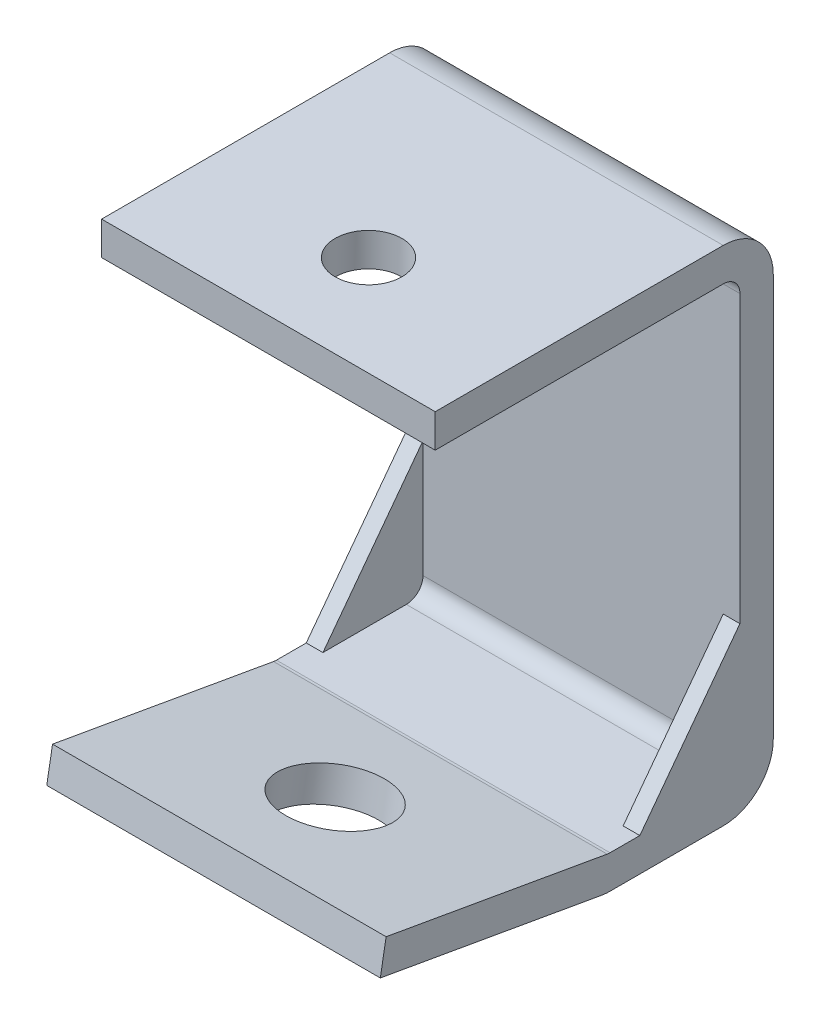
SolidWorks part; units mm, degrees
ref_plane "front" through (0, 0, 0) normal (0, 0, 1) x (1, 0, 0)
ref_plane "top" through (0, 0, 0) normal (0, 1, 0) x (1, 0, 0)
ref_plane "right" through (0, 0, 0) normal (1, 0, 0) x (0, 0, -1)
sketch "Sketch1" plane through (0, 0, 0) normal (1, 0, 0) x (0, 0, -1)
  line L0 (0, 0) -> (0, 83)
  line L1 (0, 83) -> (-58, 83)
  line L4 (-67.3467, 7.4669) -> (-25, 0)
  line L5 (-25, 0) -> (0, 0)
  dimension "D1" = 83
  dimension "D2" = 58
  dimension "D3" = 10
  dimension "D4" = 43
  dimension "D5" = 25
extrude "Base-Extrude-Thin" add sketch "Sketch1" along normal mid plane 63.5 thin
sketch "Sketch2" plane through (0, 89.35, 0) normal (0, 1, 0) x (-1, 0, 0)
  line L0 (0, 50) -> (0, -50) construction
  line L1 (-31.75, 58) -> (31.75, 58) construction
  circle A0 centre (0, 38.95) radius 6.35
  dimension "D1" = 12.7
  dimension "D2" = 19.05
extrude "Cut-Extrude1" cut sketch "Sketch2" against normal up to next
sketch "Sketch3" plane through (31.75, 0, 0) normal (1, 0, 0) x (0, 0, -1)
  line L0 (-24.7222, 0) -> (-3.175, 0) construction
  line L1 (0, 3.175) -> (0, 79.825) construction
  line L2 (-19.05, 0) -> (-3.175, 0)
  line L3 (0, 3.175) -> (0, 25.4)
  line L4 (-19.05, 0) -> (0, 25.4)
  arc A0 (-3.175, 0) -> (0, 3.175) centre (-3.175, 3.175) ccw construction
  arc A1 (-3.175, 0) -> (0, 3.175) centre (-3.175, 3.175) ccw
  dimension "D1" = 25.4
  dimension "D2" = 19.05
extrude "Boss-Extrude1" add sketch "Sketch3" against normal blind 3.175
mirror "Mirror1" about plane through (0, 0, 0) normal (1, 0, 0) of "Boss-Extrude1"
sketch "Sketch4" plane through (0, -4.2753, 0.7538) normal (0, 0.9848, -0.1736) x (-1, 0, 0)
  circle A0 centre (0, 45.2398) radius 9.525 construction
  circle A1 centre (0, 45.2398) radius 9.525
extrude "Cut-Extrude2" cut sketch "Sketch4" against normal through all
